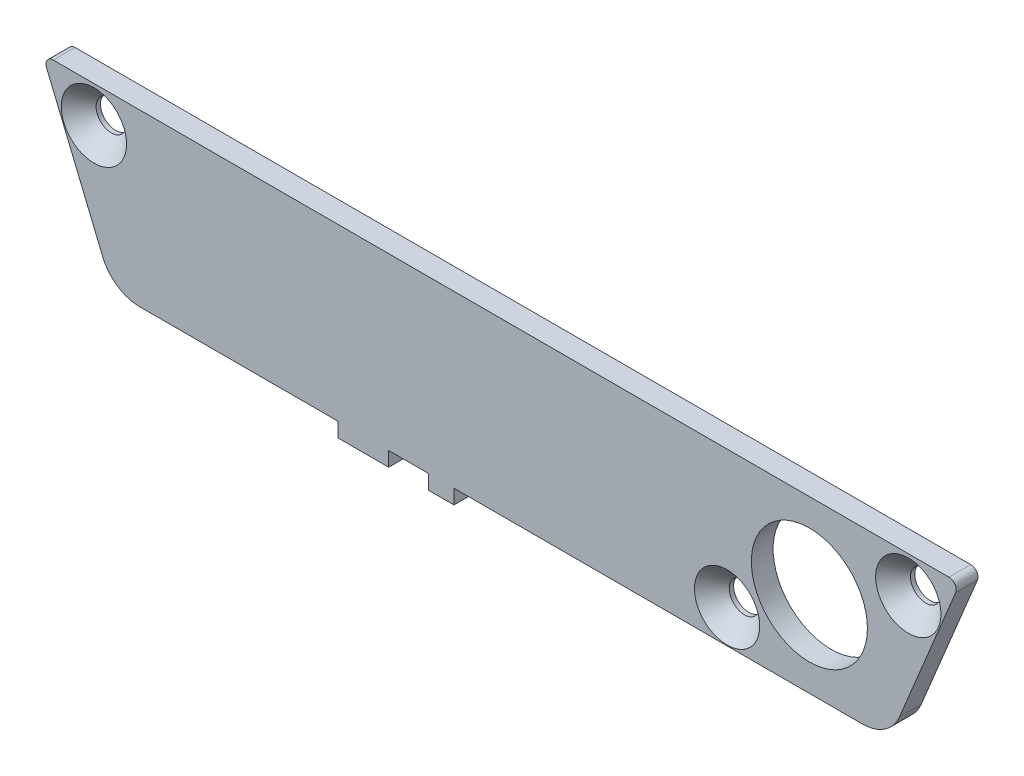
SolidWorks part; units mm, degrees
ref_plane "Plan de face" through (0, 0, 0) normal (0, 0, 1) x (1, 0, 0)
ref_plane "Plan de dessus" through (0, 0, 0) normal (0, 1, 0) x (1, 0, 0)
ref_plane "Plan de droite" through (0, 0, 0) normal (1, 0, 0) x (0, 0, -1)
sketch "Esquisse2" plane through (0, 0, 134.3496) normal (0, 0, 1) x (1, 0, 0)
  line L0 (130.5294, 76.8361) -> (7.0385, 76.8361) construction
  line L1 (130.5294, 76.8361) -> (7.0385, 76.8361)
  line L2 (6.1146, 75.4535) -> (13.8696, 56.7314) construction
  line L3 (6.1146, 75.4535) -> (13.8696, 56.7314)
  line L4 (18.9509, 53.3361) -> (46.284, 53.3361) construction
  line L5 (18.9509, 53.3361) -> (46.284, 53.3361)
  line L6 (123.6984, 56.7314) -> (131.4533, 75.4535) construction
  line L7 (123.6984, 56.7314) -> (131.4533, 75.4535)
  line L9 (62.284, 53.3361) -> (62.284, 51.3361) construction
  line L11 (62.284, 53.3361) -> (62.284, 51.3361)
  line L13 (58.784, 51.3361) -> (62.284, 51.3361) construction
  line L15 (58.784, 51.3361) -> (62.284, 51.3361)
  line L16 (58.784, 53.3361) -> (58.784, 51.3361) construction
  line L17 (58.784, 53.3361) -> (58.784, 51.3361)
  line L18 (53.284, 53.3361) -> (58.784, 53.3361) construction
  line L19 (62.284, 53.3361) -> (118.6171, 53.3361)
  line L20 (53.284, 53.3361) -> (58.784, 53.3361)
  line L21 (53.284, 51.3361) -> (53.284, 53.3361) construction
  line L22 (53.284, 51.3361) -> (53.284, 53.3361)
  line L23 (46.284, 51.3361) -> (53.284, 51.3361) construction
  line L24 (46.284, 51.3361) -> (53.284, 51.3361)
  line L25 (46.284, 53.3361) -> (46.284, 51.3361) construction
  line L26 (46.284, 53.3361) -> (46.284, 51.3361)
  arc A0 (7.0385, 76.8361) -> (6.1146, 75.4535) centre (7.0385, 75.8361) ccw construction
  arc A1 (7.0385, 76.8361) -> (6.1146, 75.4535) centre (7.0385, 75.8361) ccw
  arc A2 (13.8696, 56.7314) -> (17.0419, 53.6781) centre (18.9509, 58.8361) ccw construction
  arc A3 (13.8696, 56.7314) -> (17.0419, 53.6781) centre (18.9509, 58.8361) ccw
  arc A5 (17.0419, 53.6781) -> (18.9509, 53.3361) centre (18.9509, 58.8361) ccw
  arc A6 (118.6171, 53.3361) -> (123.6984, 56.7314) centre (118.6171, 58.8361) ccw construction
  arc A7 (118.6171, 53.3361) -> (123.6984, 56.7314) centre (118.6171, 58.8361) ccw
  arc A8 (131.4533, 75.4535) -> (130.5294, 76.8361) centre (130.5294, 75.8361) ccw construction
  arc A9 (131.4533, 75.4535) -> (130.5294, 76.8361) centre (130.5294, 75.8361) ccw
  point P12 (99.934, 57.9361)
  point P15 (12.6461, 71.8361)
  point P16 (124.9219, 71.8361)
extrude "Boss.-Extru.1" add sketch "Esquisse2" against normal blind 3
hole_wizard "Fraisage pour vis à tête fraisée M41" positions "Esquisse3" profile "Esquisse4" countersink size "M4" standard "ISO"
sketch "Esquisse3" plane through (0, 0, 134.3496) normal (0, 0, 1) x (1, 0, 0)
  point P0 (12.6461, 71.8361)
  point P3 (99.934, 57.9361)
  point P6 (124.9219, 71.8361)
sketch "Esquisse4" plane through (12.6461, 71.8361, 134.3496) normal (1, 0, 0) x (0, -1, 0)
  line L0 (0, 0) -> (0, 3)
  line L1 (0, 3) -> (2.1, 3)
  line L2 (2.1, 3) -> (2.1, 2.4)
  line L3 (2.1, 2.4) -> (4.5, 0)
  line L5 (4.5, 0) -> (0, 0)
  line L6 (-2.1, 2.4) -> (-4.5, 0) construction
  line L11 (0, -6.35) -> (0, 107.95) construction
  dimension "Diamètre du perçage jusqu'au prochain" = 4.2
  dimension "Profondeur du perçage jusqu'au prochain" = 3
  dimension "Diamètre du fraisage entrant" = 9
  dimension "Angle du fraisage entrant" = 90
sketch "Esquisse5" plane through (0, 0, 134.3496) normal (0, 0, 1) x (1, 0, 0)
  circle A1 centre (111.284, 65.0861) radius 8
  dimension "D1" = 16
extrude "Enlèv. mat.-Extru.1" cut sketch "Esquisse5" against normal up to next
